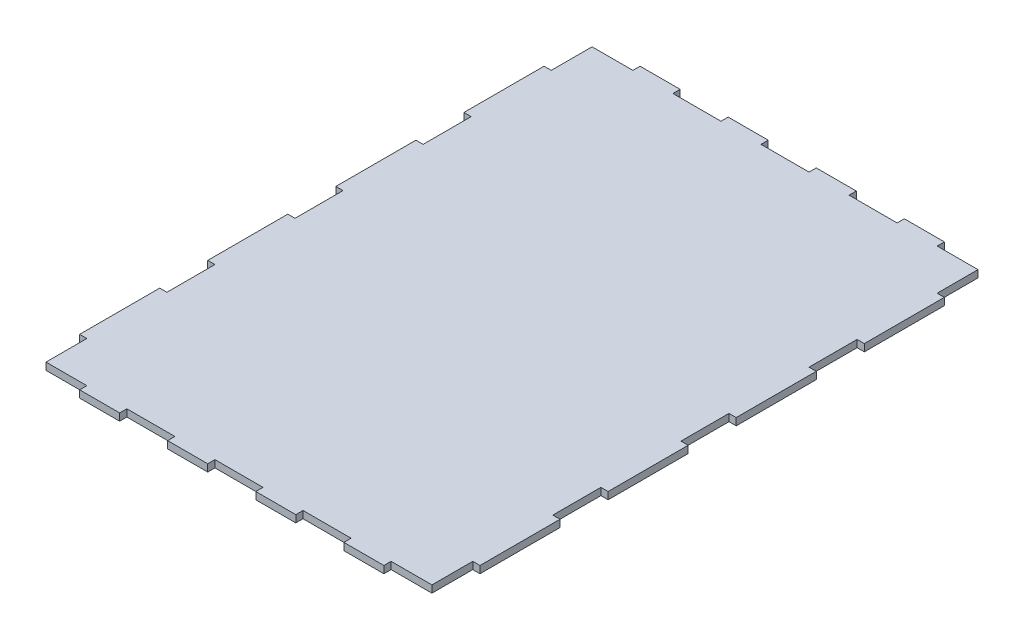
SolidWorks part; units mm, degrees
ref_plane "Front Plane" through (0, 0, 0) normal (0, 0, 1) x (1, 0, 0)
ref_plane "Top Plane" through (0, 0, 0) normal (0, 1, 0) x (1, 0, 0)
ref_plane "Right Plane" through (0, 0, 0) normal (1, 0, 0) x (0, 0, -1)
sketch "Sketch1" plane through (0, 0, 0) normal (0, 1, 0) x (1, 0, 0)
  line L1 (-241, 341) -> (241, 341)
  line L3 (-241, -341) -> (241, -341)
  line L5 (-241, -341) -> (-241, 341)
  line L6 (241, 341) -> (241, -341)
  line L30 (0, 440.4355) -> (0, 0) construction
  line L62 (0, -341) -> (0, -449.134) construction
  point P0 (0, 0)
  dimension "D1" = 682
  dimension "700" = 482
extrude "Boss-Extrude1" add sketch "Sketch1" along normal blind 9
sketch "Sketch3" plane through (0, 9, 0) normal (0, 1, 0) x (1, 0, 0)
  line L0 (241, 341) -> (-241, 341) construction
  line L1 (-190, 341) -> (-140, 341)
  line L2 (-190, 341) -> (-190, 350)
  line L3 (-190, 350) -> (-140, 350)
  line L4 (-140, 341) -> (-140, 350)
  line L6 (-80, 341) -> (-80, 350)
  line L7 (-80, 341) -> (-30, 341)
  line L8 (-30, 341) -> (-30, 350)
  line L9 (-80, 350) -> (-30, 350)
  line L10 (30, 341) -> (30, 350)
  line L11 (30, 341) -> (80, 341)
  line L12 (80, 341) -> (80, 350)
  line L13 (30, 350) -> (80, 350)
  line L14 (140, 341) -> (140, 350)
  line L15 (140, 341) -> (190, 341)
  line L16 (190, 341) -> (190, 350)
  line L17 (140, 350) -> (190, 350)
  line L18 (-408.0022, 0) -> (382.265, 0) construction
  line L19 (-190, -350) -> (-140, -350)
  line L20 (-140, -341) -> (-140, -350)
  line L21 (-190, -341) -> (-140, -341)
  line L22 (-190, -341) -> (-190, -350)
  line L23 (140, -341) -> (190, -341)
  line L24 (190, -341) -> (190, -350)
  line L25 (140, -350) -> (190, -350)
  line L26 (140, -341) -> (140, -350)
  line L27 (30, -341) -> (80, -341)
  line L28 (80, -341) -> (80, -350)
  line L29 (30, -350) -> (80, -350)
  line L30 (30, -341) -> (30, -350)
  line L31 (-80, -341) -> (-30, -341)
  line L32 (-30, -341) -> (-30, -350)
  line L33 (-80, -350) -> (-30, -350)
  line L34 (-80, -341) -> (-80, -350)
  dimension "D1" = 9
  dimension "D2" = 50
  dimension "D3" = 51
  dimension "D5" = 60
  dimension "D4" = 4
extrude "Boss-Extrude2" add sketch "Sketch3" against normal up to surface (9 mm away)
sketch "Sketch4" plane through (0, 9, 0) normal (0, 1, 0) x (1, 0, 0)
  line L0 (-241, 341) -> (-241, -341) construction
  line L1 (-241, 290) -> (-250, 290)
  line L2 (-241, 290) -> (-241, 190)
  line L3 (-241, 190) -> (-250, 190)
  line L4 (-250, 290) -> (-250, 190)
  line L6 (0, 488.2083) -> (0, -14.393) construction
  line L7 (241, 190) -> (250, 190)
  line L8 (250, 290) -> (250, 190)
  line L9 (241, 290) -> (250, 290)
  line L10 (241, 290) -> (241, 190)
  line L11 (-241, 130) -> (-241, 30)
  line L12 (-241, 130) -> (-250, 130)
  line L13 (-250, 130) -> (-250, 30)
  line L14 (-241, 30) -> (-250, 30)
  line L15 (241, 30) -> (250, 30)
  line L16 (250, 130) -> (250, 30)
  line L17 (241, 130) -> (250, 130)
  line L18 (241, 130) -> (241, 30)
  line L19 (-241, -30) -> (-241, -130)
  line L20 (-241, -30) -> (-250, -30)
  line L21 (-250, -30) -> (-250, -130)
  line L22 (-241, -130) -> (-250, -130)
  line L23 (241, -130) -> (250, -130)
  line L24 (250, -30) -> (250, -130)
  line L25 (241, -30) -> (250, -30)
  line L26 (241, -30) -> (241, -130)
  line L27 (-241, -190) -> (-241, -290)
  line L28 (-241, -190) -> (-250, -190)
  line L29 (-250, -190) -> (-250, -290)
  line L30 (-241, -290) -> (-250, -290)
  line L31 (241, -290) -> (250, -290)
  line L32 (250, -190) -> (250, -290)
  line L33 (241, -190) -> (250, -190)
  line L34 (241, -190) -> (241, -290)
  dimension "D1" = 9
  dimension "D2" = 100
  dimension "D3" = 51
  dimension "D4" = 4
extrude "Boss-Extrude3" add sketch "Sketch4" against normal up to surface (9 mm away)
